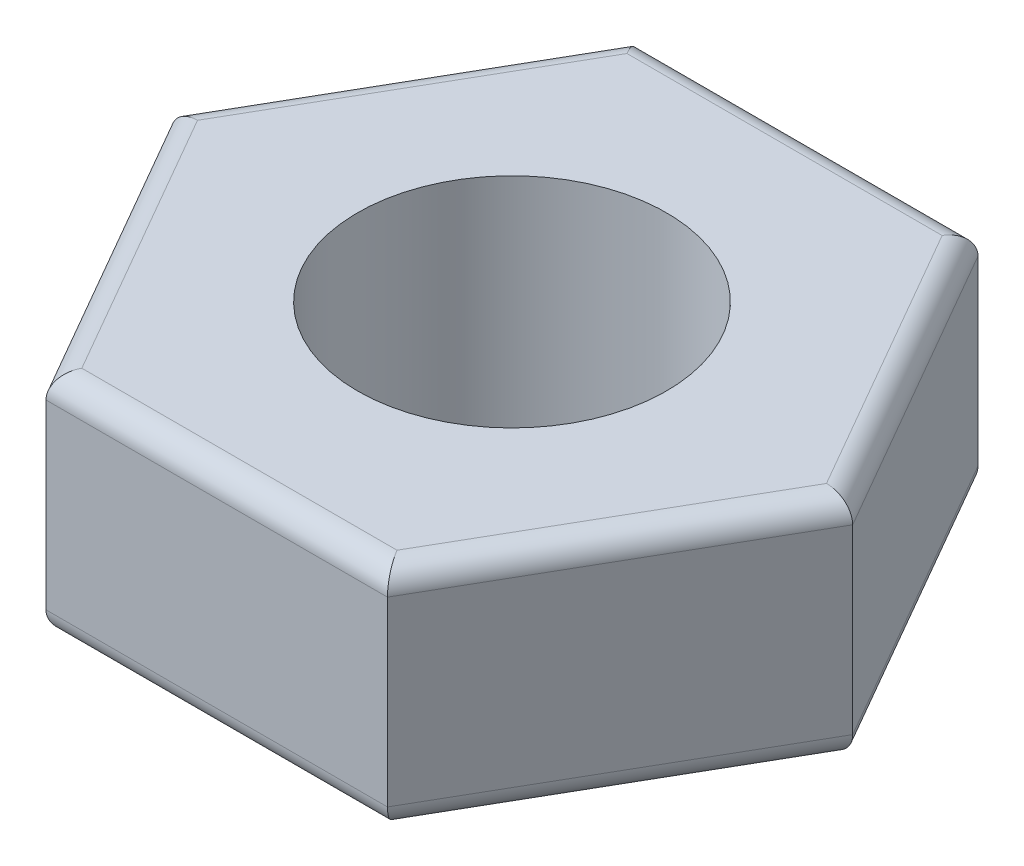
SolidWorks part; units mm, degrees
ref_plane "Plan de face" through (0, 0, 0) normal (0, 0, 1) x (1, 0, 0)
ref_plane "Plan de dessus" through (0, 0, 0) normal (0, 1, 0) x (1, 0, 0)
ref_plane "Plan de droite" through (0, 0, 0) normal (1, 0, 0) x (0, 0, -1)
sketch "Esquisse1" plane through (0, 0, 0) normal (0, 1, 0) x (1, 0, 0)
  line L0 (-7.5, 0) -> (7.5, 0) construction
  line L1 (0, -6.5) -> (0, 6.5) construction
  line L2 (-3.7583, 6.5) -> (3.7583, 6.5)
  line L3 (3.7583, 6.5) -> (7.5, 0)
  line L4 (-3.7583, 6.5) -> (-7.5, 0)
  line L5 (-3.7583, -6.5) -> (-7.5, 0)
  line L6 (3.7583, -6.5) -> (7.5, 0)
  line L7 (-3.7583, -6.5) -> (3.7583, -6.5)
  circle A0 centre (0, 0) radius 3.4
  point P8 (0, 0)
  dimension "D4" = 6.8
  dimension "D1" = 13
  dimension "D2" = 13
  dimension "D3" = 15
extrude "Extrusion1" add sketch "Esquisse1" along normal blind 5
fillet "Congé1" radius 0.5 12 edges at (0, 5, 6.5) (-5.6292, 0, 3.25) (-5.6292, 0, -3.25) (0, 0, -6.5) (5.6292, 0, -3.25) (5.6292, 0, 3.25) (0, 0, 6.5) (-5.6292, 5, 3.25) (-5.6292, 5, -3.25) (0, 5, -6.5) (5.6292, 5, -3.25) (5.6292, 5, 3.25)
